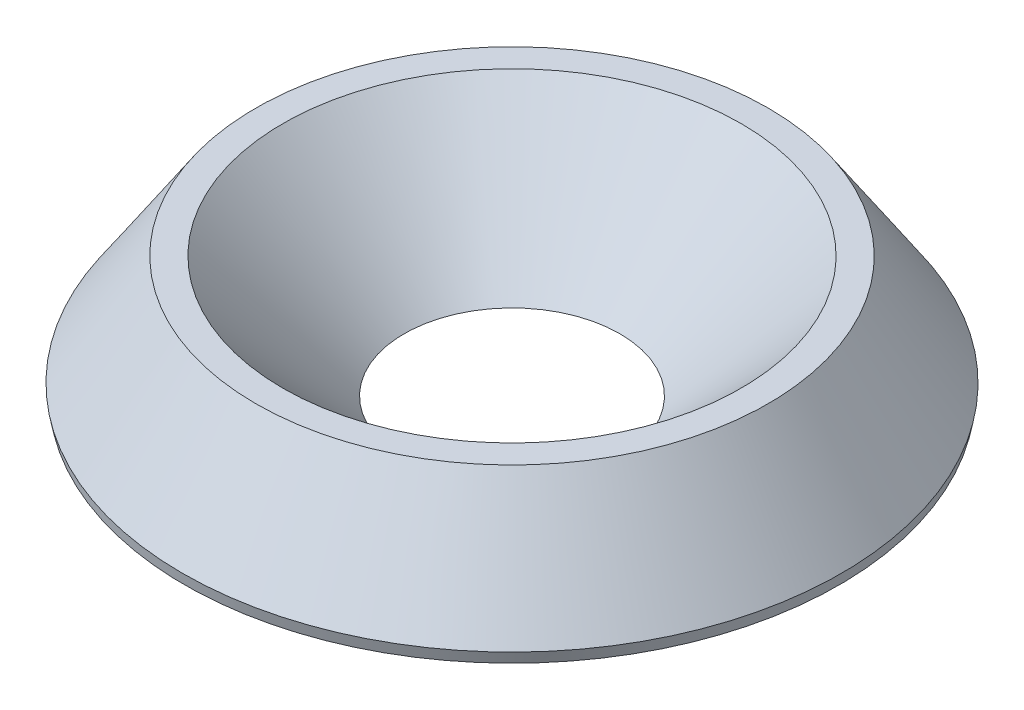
SolidWorks part; units mm, degrees
ref_plane "Face" through (0, 0, 0) normal (0, 0, 1) x (1, 0, 0)
ref_plane "Dessus" through (0, 0, 0) normal (0, 1, 0) x (1, 0, 0)
ref_plane "Droite" through (0, 0, 0) normal (1, 0, 0) x (0, 0, -1)
sketch "Esquisse1" plane through (0, 0, 0) normal (0, 0, 1) x (1, 0, 0)
  line L0 (0, 0) -> (0, 15) construction
  line L1 (8.5, 11.9641) -> (9.5, 11.9641)
  line L2 (9.5, 11.9641) -> (12.5, 7.4641)
  line L3 (12.5, 7.4641) -> (4, 7.4641)
  line L4 (4, 7.4641) -> (8.5, 11.9641)
  circle A0 centre (8, 3.4641) radius 4 construction
  dimension "D1" = 8
  dimension "D2" = 25
  dimension "D3" = 19
  dimension "D4" = 45
  dimension "D5" = 4.5
revolve "Révolution1" add sketch "Esquisse1" angle 360 about L0
chamfer "Chanfrein1" distance 0.5 angle 45
